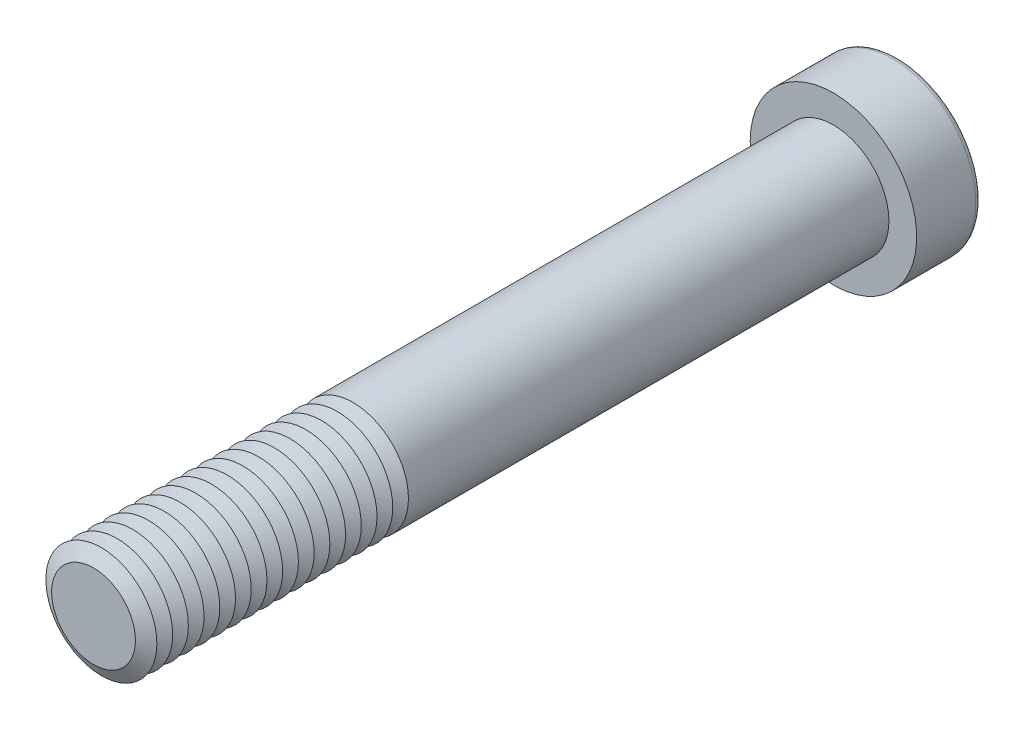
SolidWorks part; units mm, degrees
ref_plane "Front Plane" through (0, 0, 0) normal (0, 0, 1) x (1, 0, 0)
ref_plane "Top Plane" through (0, 0, 0) normal (0, 1, 0) x (1, 0, 0)
ref_plane "Right Plane" through (0, 0, 0) normal (1, 0, 0) x (0, 0, -1)
sketch "Sketch1" plane through (0, 0, 0) normal (0, 0, 1) x (1, 0, 0)
  circle A0 centre (0, 0) radius 6
  dimension "D1" = 12
extrude "Boss-Extrude1" add sketch "Sketch1" along normal blind 80
sketch "Sketch2" plane through (0, 0, 0) normal (0, 0, -1) x (-1, 0, 0)
  circle A0 centre (0, 0) radius 9
  dimension "D1" = 18
extrude "Boss-Extrude2" add sketch "Sketch2" along normal blind 7
sketch "Sketch3" plane through (0, 0, -7) normal (0, 0, -1) x (-1, 0, 0)
  line L1 (-2.3094, 4) -> (-4.6188, 0)
  line L2 (-4.6188, 0) -> (-2.3094, -4)
  line L3 (-2.3094, -4) -> (2.3094, -4)
  line L4 (2.3094, -4) -> (4.6188, 0)
  line L5 (4.6188, 0) -> (2.3094, 4)
  line L6 (2.3094, 4) -> (-2.3094, 4)
  circle A0 centre (0, 0) radius 4 construction
  dimension "D1" = 8
extrude "Cut-Extrude1" cut sketch "Sketch3" against normal blind 6
fillet "Fillet1" radius 0.6 1 edges at (-9, 0, -7)
sketch "Sketch4" plane through (0, 0, -1) normal (0, 0, -1) x (-1, 0, 0)
  line L0 (2.3094, -4) -> (4.6188, 0) construction
  circle A0 centre (0, 0) radius 4
extrude "Cut-Extrude2" cut sketch "Sketch4" against normal through all draft 60
sketch "Sketch5" plane through (0, 0, -7) normal (0, 0, -1) x (-1, 0, 0)
  circle A0 centre (0, 0) radius 4.6188
extrude "Cut-Extrude3" cut sketch "Sketch5" against normal through all draft 75
sketch "Sketch7" plane through (0, 0, 0) normal (1, 0, 0) x (0, 0, -1)
  line L25 (-80, 4.5278) -> (-79.15, 6)
  line L26 (-80, 6) -> (-80, -6) construction
  line L27 (-79.15, 6) -> (-80.85, 6)
  line L28 (-80.85, 6) -> (-80, 4.5278)
  line L29 (0, 6) -> (-80, 6) construction
  dimension "D1" = 1.7
revolve "Cut-Revolve1" cut sketch "Sketch7" angle 360 about axis through (0, 0, 80) along (0, 0, -1)
pattern_linear "LPattern1" count 17 spacing 1.7 along (0, 0, -1) of "Cut-Revolve1"
